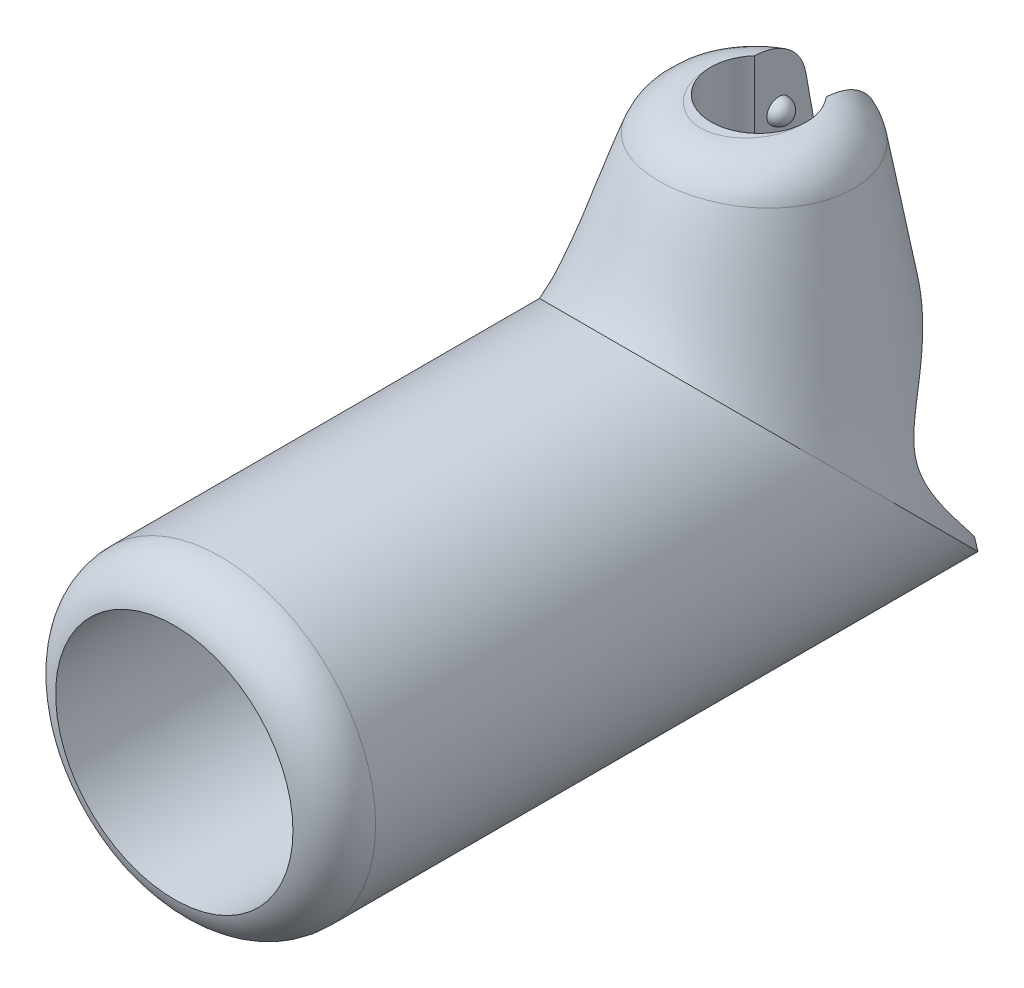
SolidWorks part; units mm, degrees
ref_plane "Alzado" through (0, 0, 0) normal (0, 0, 1) x (1, 0, 0)
ref_plane "Planta" through (0, 0, 0) normal (0, 1, 0) x (1, 0, 0)
ref_plane "Vista lateral" through (0, 0, 0) normal (1, 0, 0) x (0, 0, -1)
sketch "Croquis1" plane through (0, 0, 0) normal (0, 0, 1) x (1, 0, 0)
  circle A0 centre (0, 0) radius 6.5
extrude "Saliente-Extruir1" add sketch "Croquis1" against normal blind 31
sketch "Croquis2" plane through (0, 0, 0) normal (0, 0, 1) x (1, 0, 0)
  circle A0 centre (0, 0) radius 4.975
extrude "Cortar-Extruir1" cut sketch "Croquis2" against normal blind 4.68
sketch "Croquis3" plane through (0, 0, -4.68) normal (0, 0, 1) x (1, 0, 0)
  circle A0 centre (0, 0) radius 6.1
sketch "Croquis6" plane through (0, 0, 0) normal (1, 0, 0) x (0, 0, -1)
  line L0 (31, 6.5) -> (31, -6.5)
  line L1 (31, -6.5) -> (18, 6.5)
  line L2 (18, 6.5) -> (31, 6.5)
extrude "Cortar-Extruir3" cut sketch "Croquis6" against normal mid plane 40
sketch "Croquis7" plane through (0, 12.25, -12.25) normal (0, 0.7071, -0.7071) x (1, 0, 0)
  ellipse E1 centre (0, 17.3241) end of major axis (0, 8.1317) minor radius 6.5
  ellipse E2 centre (0, 17.3241) end of major axis (0, 8.1317) minor radius 6.5
  dimension "D1" = 0
ref_plane "Plano1" through (0, 12, 0) normal (0, 1, 0) x (1, 0, 0)
sketch "Croquis9" plane through (0, 12, 0) normal (0, 1, 0) x (1, 0, 0)
  circle A0 centre (0, 24.5) radius 3.5
sketch "Croquis12" plane through (0, 0, 0) normal (1, 0, 0) x (0, 0, -1)
  line L0 (28, 12) -> (31, -6.5)
  line L1 (28, 12) -> (21, 12) construction
  line L2 (7.2178, 12) -> (-7.2178, 12) construction
other "Límite1"
extrude "Cortar-Extruir4" cut sketch "Croquis3" against normal blind 40
sketch "Croquis13" plane through (0, 12, 0) normal (0, 1, 0) x (1, 0, 0)
  circle A0 centre (0, 24.5) radius 2
extrude "Cortar-Extruir5" cut sketch "Croquis13" against normal blind 12
fillet "Redondeo1" radius 2 2 edges at (6.5, 0, 0) (0, 12, -21)
sketch "Croquis14" plane through (0, 12, 0) normal (0, 1, 0) x (1, 0, 0)
  line L0 (0, 24.5) -> (1.5, 24.5)
  line L1 (0, 24.5) -> (-1.5, 24.5)
  line L2 (-1.5, 30.1062) -> (-1.5, 24.5)
  line L3 (-1.5, 30.1062) -> (1.5, 30.1062)
  line L4 (1.5, 30.1062) -> (1.5, 24.5)
extrude "Cortar-Extruir6" cut sketch "Croquis14" against normal blind 10
ref_plane "Plano2" through (0, 9.5, 0) normal (0, 1, 0) x (1, 0, 0)
sketch "Croquis16" plane through (0, 9.5, 0) normal (0, 1, 0) x (1, 0, 0)
  line L0 (-1.5, 26.3425) -> (-1.5, 26.8425)
  line L3 (-1.5, 28.7539) -> (-1.5, 25.8229) construction
  line L4 (-1.5, 26.8425) -> (-1, 26.8425)
  arc A0 (-1.5, 26.3425) -> (-1, 26.8425) centre (-1.5, 26.8425) ccw
revolve "Revolución1" add sketch "Croquis16" angle 360 about L4
ref_plane "Plano4" through (0, 7.3, 0) normal (0, 1, 0) x (1, 0, 0)
sketch "Croquis17" plane through (0, 7.3, 0) normal (0, 1, 0) x (1, 0, 0)
  line L0 (-1.5, 26.8425) -> (-1, 26.8425)
  line L1 (-1.5, 26.3425) -> (-1.5, 27.3425) construction
  line L2 (-1.5, 26.8425) -> (-1.5, 26.3425)
  line L3 (-1.5, 25.8229) -> (-1.5, 27.972) construction
  arc A0 (-1.5, 26.3425) -> (-1.5, 27.3425) centre (-1.5, 26.8425) ccw construction
  arc A1 (-1.5, 26.3425) -> (-1, 26.8425) centre (-1.5, 26.8425) ccw
revolve "Revolución2" add sketch "Croquis17" angle 360 about L0
sketch "Croquis18" plane through (0, 7.3, 0) normal (0, 1, 0) x (1, 0, 0)
  line L1 (1.5, 27.972) -> (1.5, 25.8229) construction
  line L2 (1.5, 26.3425) -> (1.5, 26.8425)
  line L3 (1.5, 26.8425) -> (1, 26.8425)
  arc A0 (1, 26.8425) -> (1.5, 26.3425) centre (1.5, 26.8425) ccw
revolve "Revolución3" add sketch "Croquis18" angle 360 about L3
sketch "Croquis19" plane through (0, 9.5, 0) normal (0, 1, 0) x (1, 0, 0)
  line L0 (1.5, 26.3425) -> (1.5, 26.8425)
  line L2 (1.5, 25.8229) -> (1.5, 28.7539) construction
  line L3 (1.5, 27.3425) -> (1.5, 26.3425) construction
  line L4 (1.5, 26.8425) -> (1, 26.8425)
  arc A1 (1.5, 27.3425) -> (1.5, 26.3425) centre (1.5, 26.8425) ccw construction
  arc A2 (1, 26.8425) -> (1.5, 26.3425) centre (1.5, 26.8425) ccw
revolve "Revolución4" add sketch "Croquis19" angle 360 about L4
sketch "Croquis20" plane through (0, 0, -4.68) normal (0, 0, -1) x (-1, 0, 0)
  circle A0 centre (0, 0) radius 4.975 construction
  circle A1 centre (0, 0) radius 6.1
  circle A2 centre (0, 0) radius 6.1
  circle A3 centre (0, 0) radius 4.975
  dimension "D1" = 0
extrude "Saliente-Extruir2" add sketch "Croquis20" along normal up to vertex
sketch "Croquis22" plane through (0, 0, -22.5) normal (0, 0, -1) x (-1, 0, 0)
  circle A0 centre (0, 0) radius 6.1 construction
  circle A1 centre (0, 0) radius 6.1
extrude "Saliente-Extruir3" add sketch "Croquis22" against normal blind 3
sketch "Croquis23" plane through (0, 0, -22.5) normal (0, 0, -1) x (-1, 0, 0)
  circle A0 centre (-4, 0) radius 1.2
  circle A1 centre (4, 0) radius 1.2
extrude "Cortar-Extruir7" cut sketch "Croquis23" against normal blind 3
